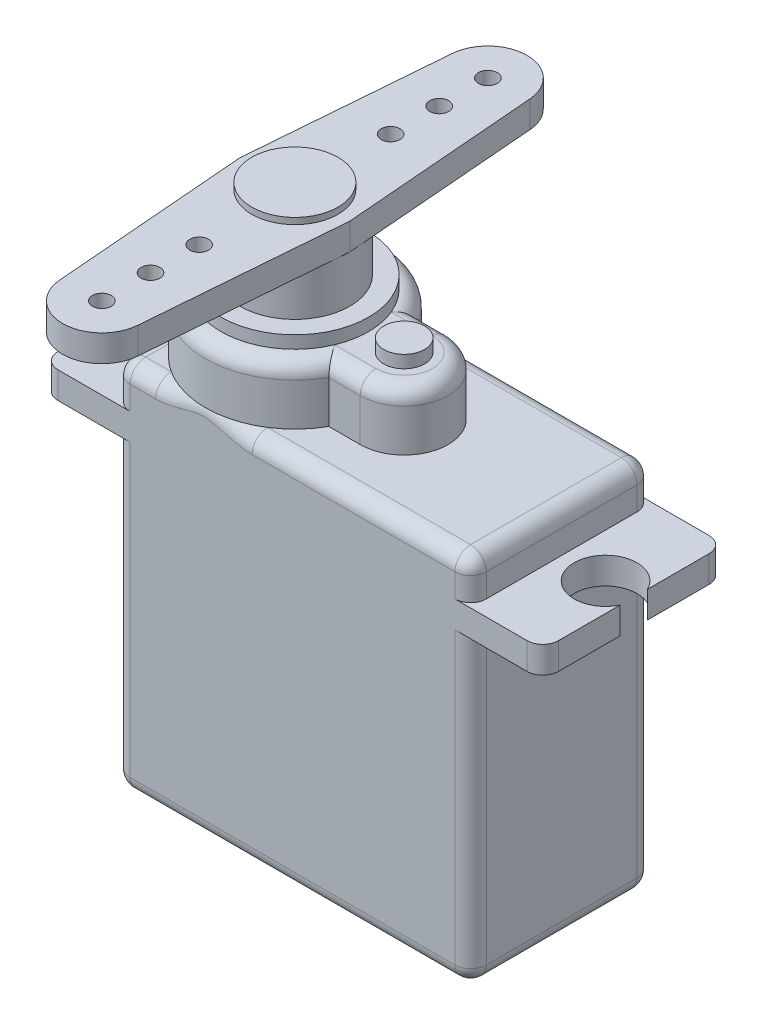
SolidWorks part; units mm, degrees
ref_plane "Спереди" through (0, 0, 0) normal (0, 0, 1) x (1, 0, 0)
ref_plane "Сверху" through (0, 0, 0) normal (0, 1, 0) x (1, 0, 0)
ref_plane "Справа" through (0, 0, 0) normal (1, 0, 0) x (0, 0, -1)
sketch "Эскиз1" plane through (0, 0, 0) normal (0, 1, 0) x (1, 0, 0)
  line L1 (0, 5.8) -> (22.7, 5.8)
  line L2 (0, 5.8) -> (0, -5.8)
  line L3 (0, -5.8) -> (22.7, -5.8)
  line L4 (22.7, 5.8) -> (22.7, -5.8)
  dimension "D1" = 22.7
  dimension "D2" = 11.6
extrude "Бобышка-Вытянуть1" add sketch "Эскиз1" along normal blind 19.5
sketch "Эскиз2" plane through (0, 19.5, 0) normal (0, 1, 0) x (1, 0, 0)
  line L0 (-4.6, 5.8) -> (27.3, 5.8)
  line L1 (27.3, 5.8) -> (27.3, -5.8)
  line L2 (27.3, -5.8) -> (-4.6, -5.8)
  line L3 (-4.6, -5.8) -> (-4.6, 5.8)
  line L4 (22.7, -5.8) -> (22.7, 5.8) construction
  line L5 (0, 5.8) -> (0, -5.8) construction
  dimension "D1" = 4.6
  dimension "D2" = 4.6
extrude "Бобышка-Вытянуть2" add sketch "Эскиз2" along normal blind 1.7
sketch "Эскиз3" plane through (0, 21.2, 0) normal (0, 1, 0) x (1, 0, 0)
  line L0 (0, 5.8) -> (22.7, 5.8)
  line L1 (27.3, 5.8) -> (-4.6, 5.8) construction
  line L2 (22.7, 5.8) -> (22.7, -5.8)
  line L3 (-4.6, -5.8) -> (27.3, -5.8) construction
  line L4 (22.7, -5.8) -> (0, -5.8)
  line L5 (0, -5.8) -> (0, 5.8)
extrude "Бобышка-Вытянуть3" add sketch "Эскиз3" along normal blind 2.5
sketch "Эскиз4" plane through (0, 23.7, 0) normal (0, 1, 0) x (1, 0, 0)
  line L0 (0, 0) -> (22.7, 0) construction
  line L1 (22.7, -5.8) -> (22.7, 5.8) construction
  line L2 (10.6649, 2.8) -> (10.6649, -2.8) construction
  line L3 (10.6649, 2.8) -> (12.6649, 2.8)
  line L4 (12.6649, 2.8) -> (12.6649, -2.8) construction
  line L5 (12.6649, -2.8) -> (10.6649, -2.8)
  line L6 (0, 5.8) -> (0, -5.8) construction
  arc A0 (10.6649, 2.8) -> (10.6649, -2.8) centre (5.7, 0) ccw
  arc A1 (12.6649, -2.8) -> (12.6649, 2.8) centre (12.6649, 0) ccw
  dimension "D1" = 5.7
  dimension "D2" = 5.7
  dimension "D3" = 5.6
  dimension "D4" = 2
extrude "Бобышка-Вытянуть4" add sketch "Эскиз4" along normal blind 3.7
sketch "Эскиз5" plane through (0, 27.4, 0) normal (0, 1, 0) x (1, 0, 0)
  circle A0 centre (5.7, 0) radius 4.7
  circle A1 centre (12.6649, 0) radius 1.3
  dimension "D1" = 2.6
  dimension "D2" = 9.4
extrude "Бобышка-Вытянуть5" add sketch "Эскиз5" along normal blind 0.8
sketch "Эскиз6" plane through (0, 21.2, 0) normal (0, 1, 0) x (1, 0, 0)
  line L0 (-4.6, 0) -> (27.3, 0) construction
  line L1 (-4.6, 5.8) -> (-4.6, -5.8) construction
  line L2 (27.3, -5.8) -> (27.3, 5.8) construction
  circle A0 centre (-2.8, 0) radius 2
  circle A1 centre (25.5, 0) radius 2
  dimension "D1" = 4
  dimension "D2" = 4
  dimension "D3" = 1.8
  dimension "D4" = 31.9
  dimension "D5" = 1.8
extrude "Вырез-Вытянуть1" cut sketch "Эскиз6" against normal up to next
fillet "Скругление1" radius 1 12 edges at (-4.6, 20.35, 5.8) (-4.6, 20.35, -5.8) (27.3, 20.35, -5.8) (27.3, 20.35, 5.8)
fillet "Скругление2" radius 1 4 edges at (11.6649, 27.4, 2.8) (15.4649, 27.4, 0) (11.6649, 27.4, -2.8) (0, 27.4, 0)
fillet "Скругление3" radius 1 17 edges at (0.2929, 0, 5.5071) (0, 0, 0) (0.2929, 0, -5.5071) (11.35, 0, -5.8) (22.4071, 0, -5.5071) (22.7, 0, 0) (22.4071, 0, 5.5071) (0.2929, 23.7, 5.5071) (0, 23.7, 2.4) (0, 23.7, -2.4) (0.2929, 23.7, -5.5071) (11.35, 23.7, -5.8) (22.4071, 23.7, -5.5071) (22.7, 23.7, 0) (22.4071, 23.7, 5.5071) (11.35, 0, 5.8) (11.35, 23.7, 5.8)
sketch "Эскиз7" plane through (0, 28.2, 0) normal (0, 1, 0) x (1, 0, 0)
  circle A0 centre (5.7, 0) radius 3.5
  dimension "D1" = 7
extrude "Бобышка-Вытянуть6" add sketch "Эскиз7" along normal blind 3 separate body
sketch "Эскиз8" plane through (0, 31.2, 0) normal (0, 1, 0) x (1, 0, 0)
  line L0 (2.2, 0) -> (9.2, 0) construction
  line L1 (5.7, -3.5) -> (5.7, 3.5) construction
  line L6 (5.7, 3.5) -> (5.7, 12.3) construction
  line L7 (5.7, -3.5) -> (5.7, -12.3) construction
  line L8 (9.2, 0) -> (8.1919, -12.501)
  line L9 (2.2, 0) -> (3.2081, -12.501)
  line L10 (2.2, 0) -> (3.2081, 12.501)
  line L11 (9.2, 0) -> (8.1919, 12.501)
  circle A0 centre (5.7, 0) radius 3.5 construction
  arc A9 (3.2081, 12.501) -> (8.1919, 12.501) centre (5.7, 12.3) cw
  arc A10 (8.1919, -12.501) -> (3.2081, -12.501) centre (5.7, -12.3) cw
  circle A11 centre (5.7, -12.3) radius 0.6
  circle A12 centre (5.7, -9.2) radius 0.6
  circle A13 centre (5.7, -6.1) radius 0.6
  circle A14 centre (5.7, 12.3) radius 0.6
  circle A15 centre (5.7, 9.2) radius 0.6
  circle A16 centre (5.7, 6.1) radius 0.6
  dimension "D15" = 2.5
  dimension "D16" = 2.5
  dimension "D19" = 1.2
  dimension "D20" = 1.2
  dimension "D21" = 1.2
  dimension "D22" = 1.2
  dimension "D23" = 1.2
  dimension "D24" = 1.2
  dimension "D17" = 12.3
  dimension "D18" = 12.3
  dimension "D25" = 3.1
  dimension "D26" = 3.1
  dimension "D27" = 3.1
  dimension "D28" = 3.1
extrude "Бобышка-Вытянуть7" add sketch "Эскиз8" along normal blind 1.7
sketch "Эскиз9" plane through (0, 32.9, 0) normal (0, 1, 0) x (1, 0, 0)
  circle A1 centre (5.7, 0) radius 2.75
  dimension "D1" = 5.5
extrude "Бобышка-Вытянуть8" add sketch "Эскиз9" along normal blind 0.4
